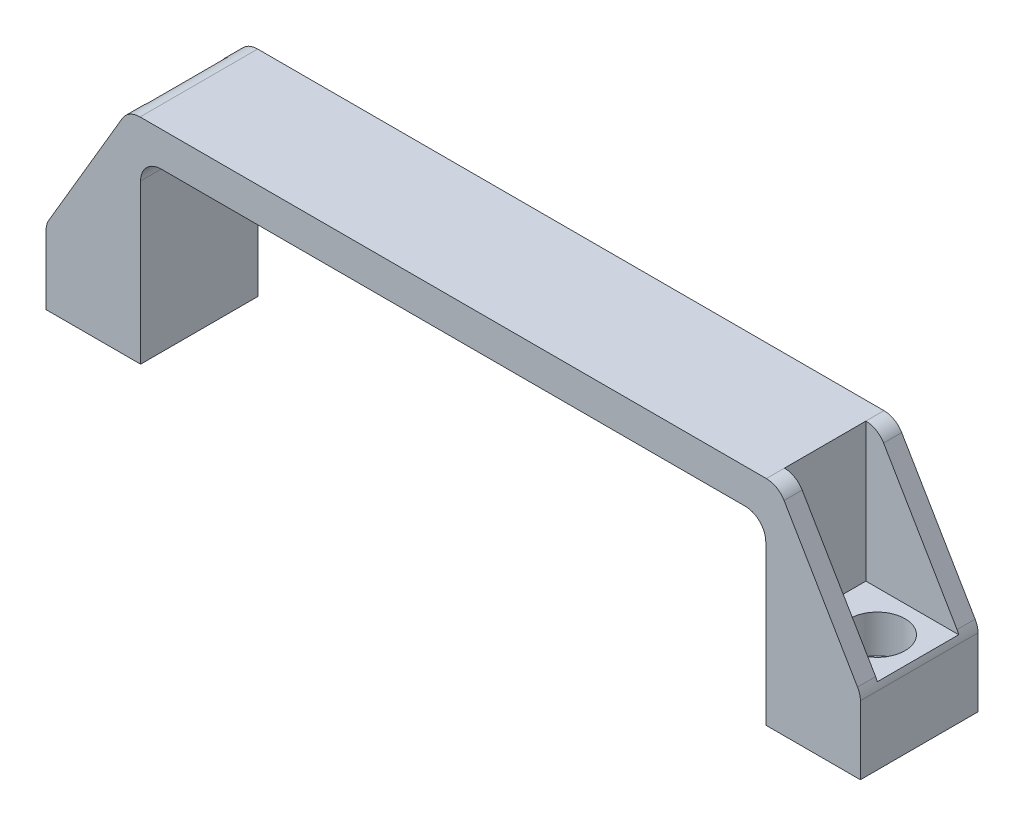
SolidWorks part; units mm, degrees
ref_plane "Plan de face" through (0, 0, 0) normal (0, 0, 1) x (1, 0, 0)
ref_plane "Plan de dessus" through (0, 0, 0) normal (0, 1, 0) x (1, 0, 0)
ref_plane "Plan de droite" through (0, 0, 0) normal (1, 0, 0) x (0, 0, -1)
sketch "Esquisse1" plane through (0, 0, 0) normal (0, 0, 1) x (1, 0, 0)
  line L0 (0, 0) -> (23, 0)
  line L1 (23, 0) -> (23, 43.6)
  line L2 (0, 0) -> (0, 18)
  line L3 (0, 18) -> (20, 52)
  line L4 (20, 52) -> (178, 52)
  line L5 (99, 82.8805) -> (99, -6.6744) construction
  line L6 (23, 43.6) -> (175, 43.6)
  line L7 (198, 18) -> (178, 52)
  line L8 (198, 0) -> (198, 18)
  line L9 (175, 0) -> (175, 43.6)
  line L10 (198, 0) -> (175, 0)
  point P11 (99, 52)
  point P12 (99, 43.6)
  dimension "D1" = 23
  dimension "D2" = 52
  dimension "D3" = 8.4
  dimension "D4" = 18
  dimension "D5" = 20
  dimension "D6" = 76
  dimension "D7" = 198
extrude "Extrusion1" add sketch "Esquisse1" along normal blind 28.6
fillet "Congé1" radius 5 1 edges at (178, 52, 14.3)
fillet "Congé2" radius 5 1 edges at (20, 52, 14.3)
fillet "Congé3" radius 5 2 edges at (23, 43.6, 14.3) (175, 43.6, 14.3)
fillet "Congé4" radius 5 2 edges at (0, 18, 14.3) (198, 18, 14.3)
sketch "Esquisse2" plane through (0, 52, 0) normal (0, 1, 0) x (1, 0, 0)
  line L1 (175.1403, -4.4) -> (198, -4.4)
  line L2 (175.1403, -28.6) -> (175.1403, 0) construction
  line L3 (175.1403, -24.2) -> (198, -24.2)
  line L4 (198, -4.4) -> (198, -24.2)
  line L5 (198, 0) -> (198, -28.6) construction
  line L6 (197.3097, 0) -> (179.4499, 0) construction
  line L7 (197.3097, -28.6) -> (179.4499, -28.6) construction
  line L9 (20, -4.4) -> (0, -4.4)
  line L11 (20, -24.2) -> (0, -24.2)
  line L12 (0, -4.4) -> (0, -24.2)
  line L13 (0, -28.6) -> (0, 0) construction
  line L14 (18.5501, 0) -> (0.6903, 0) construction
  line L15 (18.5501, -28.6) -> (0.6903, -28.6) construction
  line L16 (20, -4.4) -> (20, -24.2)
  line L17 (175.1403, -4.4) -> (175.1403, -24.2)
  dimension "D1" = 4.4
  dimension "D2" = 4.4
  dimension "D3" = 4.4
  dimension "D4" = 4.4
  dimension "D5" = 20
extrude "Extrusion2" cut sketch "Esquisse2" against normal blind 33.7
sketch "Esquisse3" plane through (0, 52, 0) normal (0, 1, 0) x (1, 0, 0)
  line L0 (0.2841, -14.3) -> (201.7031, -14.3) construction
  line L1 (0.2841, -4.4) -> (0.2841, -24.2) construction
  line L2 (198, -24.2) -> (198, -4.4) construction
  line L4 (0, -4.4) -> (0, -24.2) construction
  circle A0 centre (10.2, -14.3) radius 4.1
  circle A1 centre (187.8, -14.3) radius 4.1
  point P6 (198, -14.3)
  dimension "D1" = 8.2
  dimension "D3" = 8.2
  dimension "D4" = 10.2
  dimension "D2" = 10.2
extrude "Extrusion5" cut sketch "Esquisse3" against normal through all
sketch "Esquisse4" plane through (0, 18.3, 0) normal (0, 1, 0) x (1, 0, 0)
  circle A0 centre (10.2, -14.3) radius 6.75
  circle A1 centre (187.8, -14.3) radius 6.75
  dimension "D1" = 13.5
  dimension "D2" = 13.5
extrude "Extrusion6" cut sketch "Esquisse4" against normal blind 9.2
